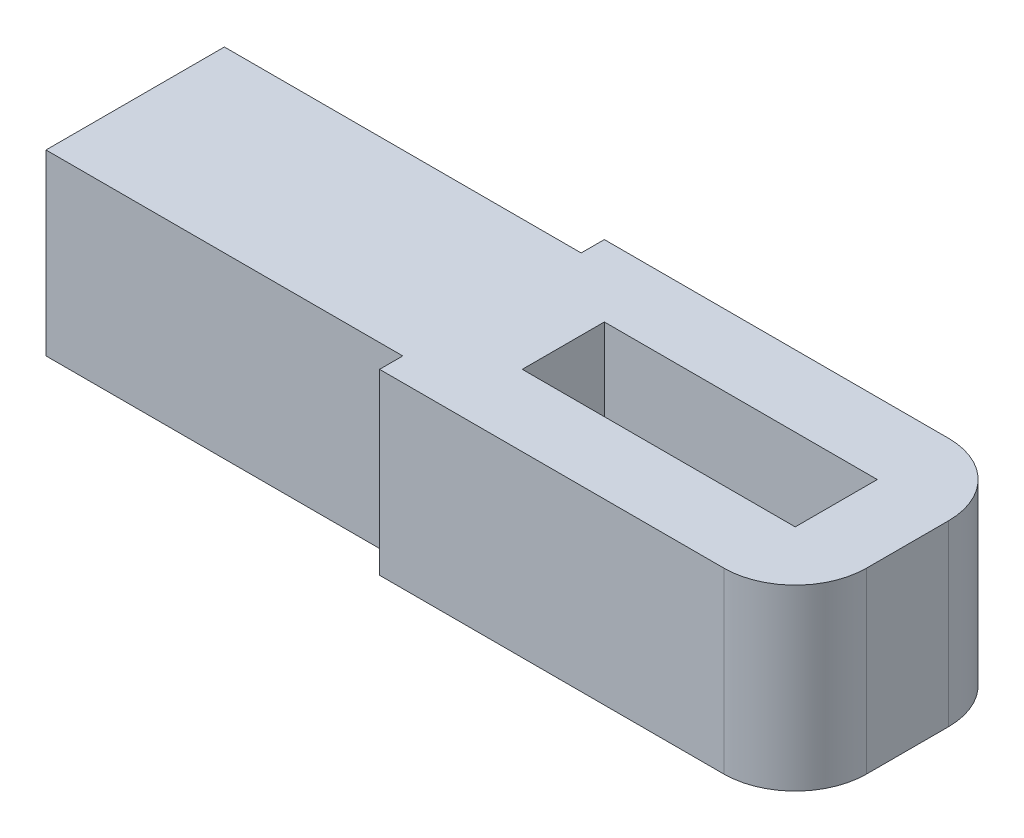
SolidWorks part; units mm, degrees
ref_plane "Plan de face" through (0, 0, 0) normal (0, 0, 1) x (1, 0, 0)
ref_plane "Plan de dessus" through (0, 0, 0) normal (0, 1, 0) x (1, 0, 0)
ref_plane "Plan de droite" through (0, 0, 0) normal (1, 0, 0) x (0, 0, -1)
sketch "Esquisse1" plane through (0, 0, 0) normal (0, 1, 0) x (1, 0, 0)
  line L0 (0, 1.15) -> (0, 3.15) construction
  line L1 (-5.825, 3.15) -> (5.825, 3.15)
  line L2 (-5.825, 3.15) -> (-5.825, -3.15)
  line L3 (-5.825, -3.15) -> (5.825, -3.15)
  line L4 (5.825, 3.15) -> (5.825, -3.15)
  line L5 (-5.825, 3.15) -> (5.825, -3.15) construction
  line L6 (-5.825, -3.15) -> (5.825, 3.15) construction
  line L7 (-3.825, 1.15) -> (3.825, 1.15)
  line L8 (-3.825, 1.15) -> (-3.825, -1.15)
  line L9 (-3.825, -1.15) -> (3.825, -1.15)
  line L10 (3.825, 1.15) -> (3.825, -1.15)
  line L11 (-3.825, 1.15) -> (3.825, -1.15) construction
  line L12 (-3.825, -1.15) -> (3.825, 1.15) construction
  line L13 (-3.825, 0) -> (-5.825, 0) construction
  point P0 (0, 0)
  point P6 (0, 0)
  dimension "D1" = 7.65
  dimension "D2" = 2.3
  dimension "D3" = 2
extrude "Boss.-Extru.1" add sketch "Esquisse1" along normal blind 5
fillet "Congé1" radius 2 2 edges at (5.825, 2.5, 3.15) (5.825, 2.5, -3.15)
ref_plane "Plan1" through (0, 0, 0) normal (0, 0, 1) x (1, 0, 0)
ref_plane "Plan2" through (-5.825, 5, -3.15) normal (0, 0, 1) x (1, 0, 0)
sketch "Esquisse3" plane through (0, 5, 0) normal (0, 1, 0) x (1, 0, 0)
  line L0 (-5.825, 3.15) -> (-5.825, -3.15) construction
  line L1 (-5.825, 2.5) -> (-15.825, 2.5)
  line L2 (-5.825, 2.5) -> (-5.825, -2.5)
  line L3 (-5.825, -2.5) -> (-15.825, -2.5)
  line L4 (-15.825, 2.5) -> (-15.825, -2.5)
  line L5 (-2.75, 0) -> (2.75, 0) construction
  point P9 (-15.825, 0)
  dimension "D1" = 5
  dimension "D2" = 10
extrude "Boss.-Extru.2" add sketch "Esquisse3" against normal up to surface (5 mm away)
